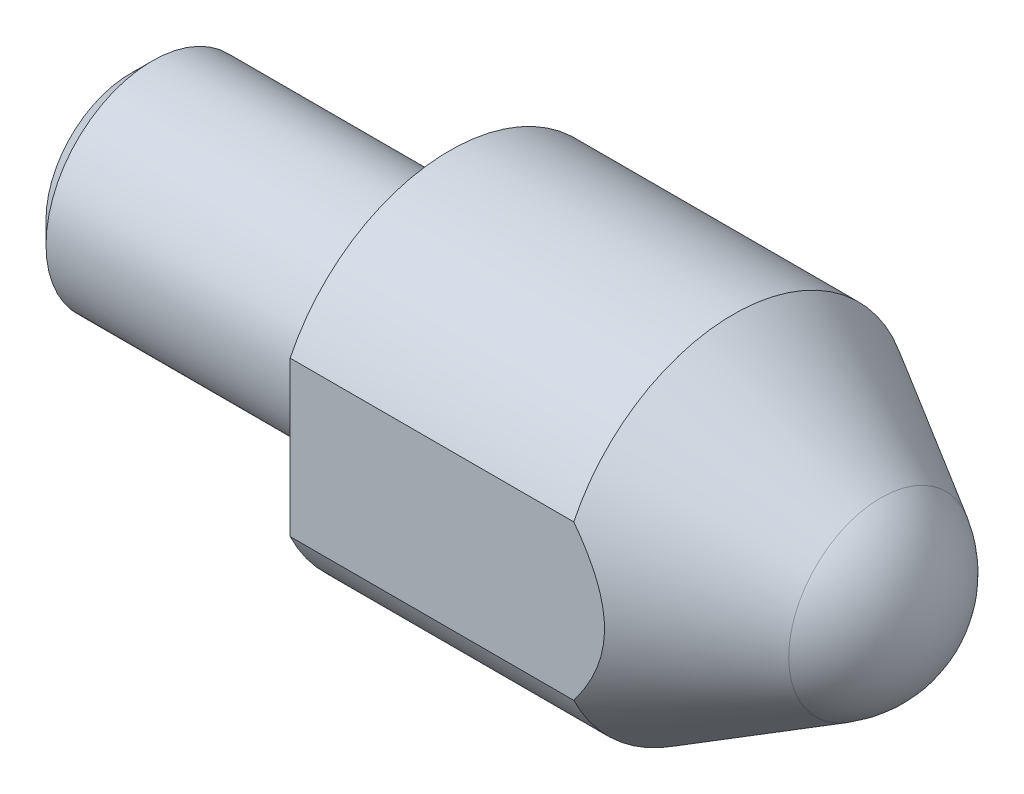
SolidWorks part; units mm, degrees
ref_plane "Front X-Y" through (0, 0, 0) normal (0, 0, 1) x (1, 0, 0)
ref_plane "Top X-Z" through (0, 0, 0) normal (0, 1, 0) x (1, 0, 0)
ref_plane "Right Y-Z" through (0, 0, 0) normal (1, 0, 0) x (0, 0, -1)
ref_plane "Plane1" through (0, 0, 0) normal (0, 0, 1) x (1, 0, 0)
sketch "Sketch1" plane through (0, 0, 0) normal (0, 0, 1) x (1, 0, 0)
  line L0 (-9, 0) -> (-9, 2.3865)
  line L1 (-9, 2.3865) -> (-8.3865, 3)
  line L2 (-8.3865, 3) -> (0, 3)
  line L3 (0, 3) -> (0, 0)
  line L4 (0, 0) -> (-9, 0)
  line L5 (0, 0) -> (-9, 0) construction
  line L6 (0, 0) -> (3.7445, 0) construction
  dimension "D1" = 9
  dimension "D2" = 6
revolve "Revolve1" add sketch "Sketch1" angle 360 about L5
ref_plane "Plane2" through (0, 0, 0) normal (0, 0, 1) x (1, 0, 0)
sketch "Sketch2" plane through (0, 0, 0) normal (0, 0, 1) x (1, 0, 0)
  line L0 (0, 0) -> (0, 5)
  line L1 (0, 5) -> (8, 5)
  line L2 (8, 5) -> (12.1603, 2.5981)
  line L3 (13.6603, 0) -> (0, 0)
  line L4 (13.6603, 0) -> (0, 0) construction
  line L6 (0, -3) -> (0, 3) construction
  line L7 (0, 0) -> (-14.149, 0) construction
  arc A0 (12.1603, 2.5981) -> (13.6603, 0) centre (10.6603, 0) cw
  dimension "D1" = 3
  dimension "D2" = 10
  dimension "D3" = 30
  dimension "D4" = 8
revolve "Revolve2" add sketch "Sketch2" angle 360 about L4
ref_plane "Plane3" through (-1, 0, 0) normal (1, 0, 0) x (0, 0, -1)
sketch "Sketch3" plane through (-1, 0, 0) normal (1, 0, 0) x (0, 0, -1)
  line L0 (-18, 20) -> (-18, -20)
  line L1 (-18, -20) -> (18, -20)
  line L2 (18, -20) -> (18, 20)
  line L3 (18, 20) -> (-18, 20)
  line L4 (-4.5, 10) -> (-4.5, -10)
  line L5 (-4.5, -10) -> (4.5, -10)
  line L6 (4.5, -10) -> (4.5, 10)
  line L7 (4.5, 10) -> (-4.5, 10)
extrude "Cut-Extrude1" cut sketch "Sketch3" along normal blind 13
